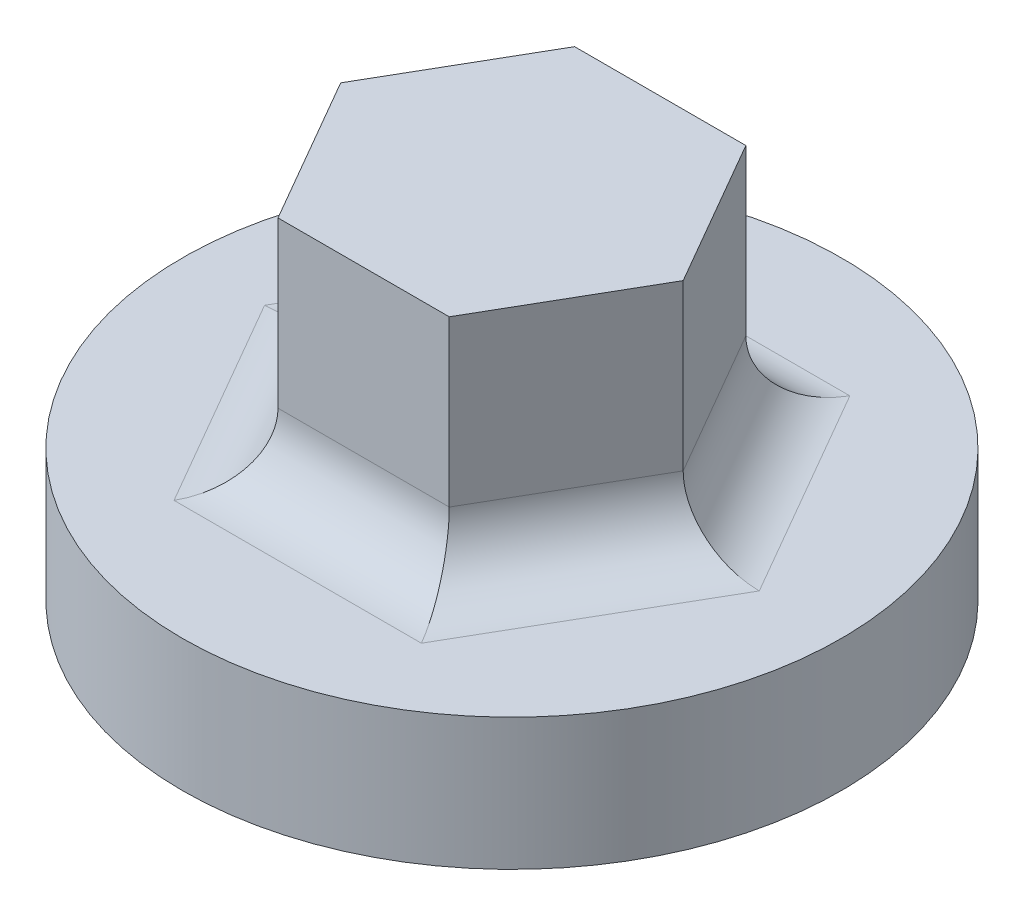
SolidWorks part; units mm, degrees
ref_plane "Front" through (0, 0, 0) normal (0, 0, 1) x (1, 0, 0)
ref_plane "Top" through (0, 0, 0) normal (0, 1, 0) x (1, 0, 0)
ref_plane "Right" through (0, 0, 0) normal (1, 0, 0) x (0, 0, -1)
sketch "Sketch1" plane through (0, 0, 0) normal (0, 1, 0) x (1, 0, 0)
  circle A0 centre (0, 0) radius 50
  dimension "D1" = 100
extrude "Extrude1" add sketch "Sketch1" along normal blind 20
sketch "Sketch2" plane through (0, 20, 0) normal (0, 1, 0) x (-1, 0, 0)
  line L0 (25.9808, 0) -> (12.9904, 22.5)
  line L1 (12.9904, 22.5) -> (-12.9904, 22.5)
  line L2 (-12.9904, 22.5) -> (-25.9808, 0)
  line L3 (-25.9808, 0) -> (-12.9904, -22.5)
  line L4 (-12.9904, -22.5) -> (12.9904, -22.5)
  line L5 (12.9904, -22.5) -> (25.9808, 0)
  circle A0 centre (0, 0) radius 22.5 construction
  dimension "D1" = 45
extrude "Extrude2" add sketch "Sketch2" along normal blind 35
fillet "Fillet3" radius 10 6 edges at (-19.4856, 20, 11.25) (-19.4856, 20, -11.25) (0, 20, -22.5) (19.4856, 20, -11.25) (0, 20, 22.5) (19.4856, 20, 11.25)
